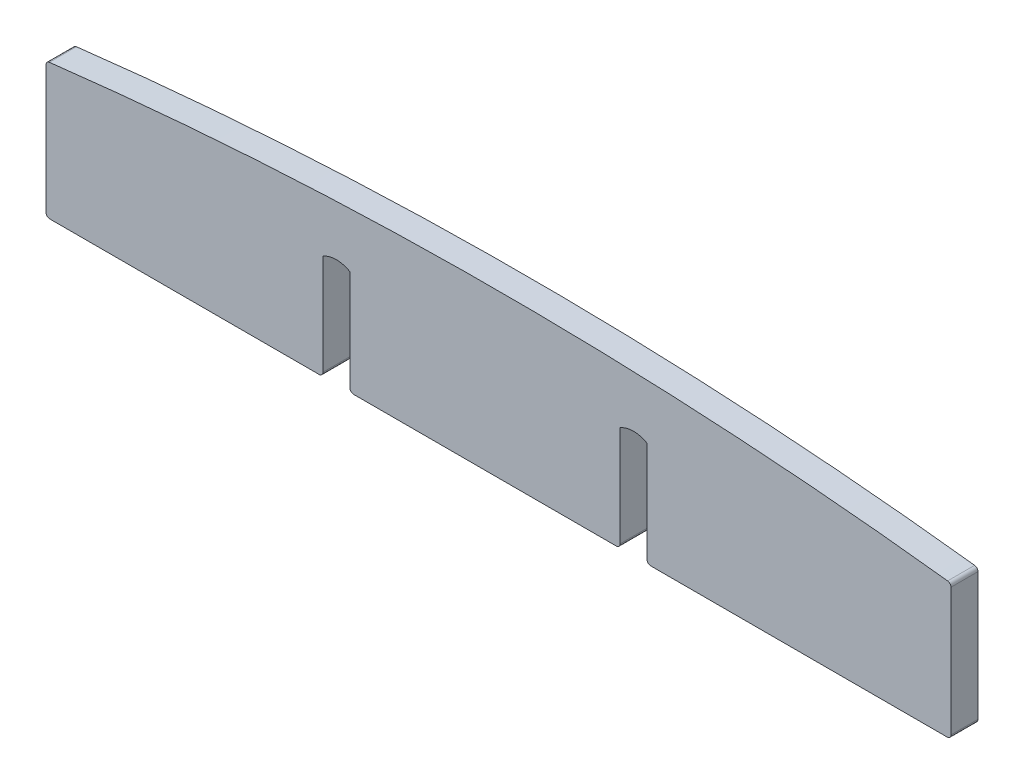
SolidWorks part; units mm, degrees
ref_plane "Plano frontal" through (0, 0, 0) normal (0, 0, 1) x (1, 0, 0)
ref_plane "Plano superior" through (0, 0, 0) normal (0, 1, 0) x (1, 0, 0)
ref_plane "Plano direito" through (0, 0, 0) normal (1, 0, 0) x (0, 0, -1)
sketch "Esboço1" plane through (0, 0, 0) normal (0, 0, 1) x (1, 0, 0)
  line L0 (-11, -7.7321) -> (-11, -1.7321) construction
  line L1 (-9.7178, -7.7321) -> (9.7178, -7.7321)
  line L2 (-32.5, 2.0175) -> (-32.5, -7.4499)
  line L3 (-32.2178, -7.7321) -> (-12.2822, -7.7321)
  line L4 (34.5, 2.0175) -> (34.5, -7.4499)
  line L5 (-31.9185, 7.1535) -> (34.5, -7.7321) construction
  line L6 (-32.5, -7.7321) -> (33.7179, 8.0218) construction
  line L7 (-12, -7.4499) -> (-12, 0)
  line L8 (-10, -7.4499) -> (-10, 0)
  line L9 (11, -7.7321) -> (11, -1.7321) construction
  line L10 (10, -7.4499) -> (10, 0)
  line L11 (12, -7.4499) -> (12, 0)
  line L12 (0.609, 0.1449) -> (0.609, 10.8472) construction
  line L13 (12.2822, -7.7321) -> (34.2178, -7.7321)
  arc A0 (-32.2512, 2.2977) -> (34.2512, 2.2977) centre (1, -277.2946) cw
  arc A1 (-32.5, -7.4499) -> (-32.2178, -7.7321) centre (-32.2178, -7.4499) ccw
  arc A2 (-10, 0) -> (-12, 0) centre (-11, -1.7321) ccw
  arc A3 (-32.2512, 2.2977) -> (-32.5, 2.0175) centre (-32.2178, 2.0175) ccw
  arc A4 (12, 0) -> (10, 0) centre (11, -1.7321) ccw
  arc A5 (34.2512, 2.2977) -> (34.5, 2.0175) centre (34.2178, 2.0175) cw
  arc A6 (34.2178, -7.7321) -> (34.5, -7.4499) centre (34.2178, -7.4499) ccw
  arc A7 (12, -7.4499) -> (12.2822, -7.7321) centre (12.2822, -7.4499) ccw
  arc A8 (10, -7.4499) -> (9.7178, -7.7321) centre (9.7178, -7.4499) cw
  arc A9 (-10, -7.4499) -> (-9.7178, -7.7321) centre (-9.7178, -7.4499) ccw
  arc A10 (-12, -7.4499) -> (-12.2822, -7.7321) centre (-12.2822, -7.4499) cw
  point P0 (0, 0)
  point P11 (-12, -3)
  point P16 (12, -3)
  point P30 (-32.5, 2.2679)
  point P33 (34.5, 2.2679)
  dimension "D1" = 0.2822
  dimension "D2" = 67
  dimension "D3" = 10
  dimension "D4" = 2
  dimension "D5" = 2
  dimension "D6" = 8
  dimension "D7" = 8
  dimension "D8" = 20
  dimension "D9" = 10
extrude "Ressalto-extrusão1" add sketch "Esboço1" along normal blind 2
